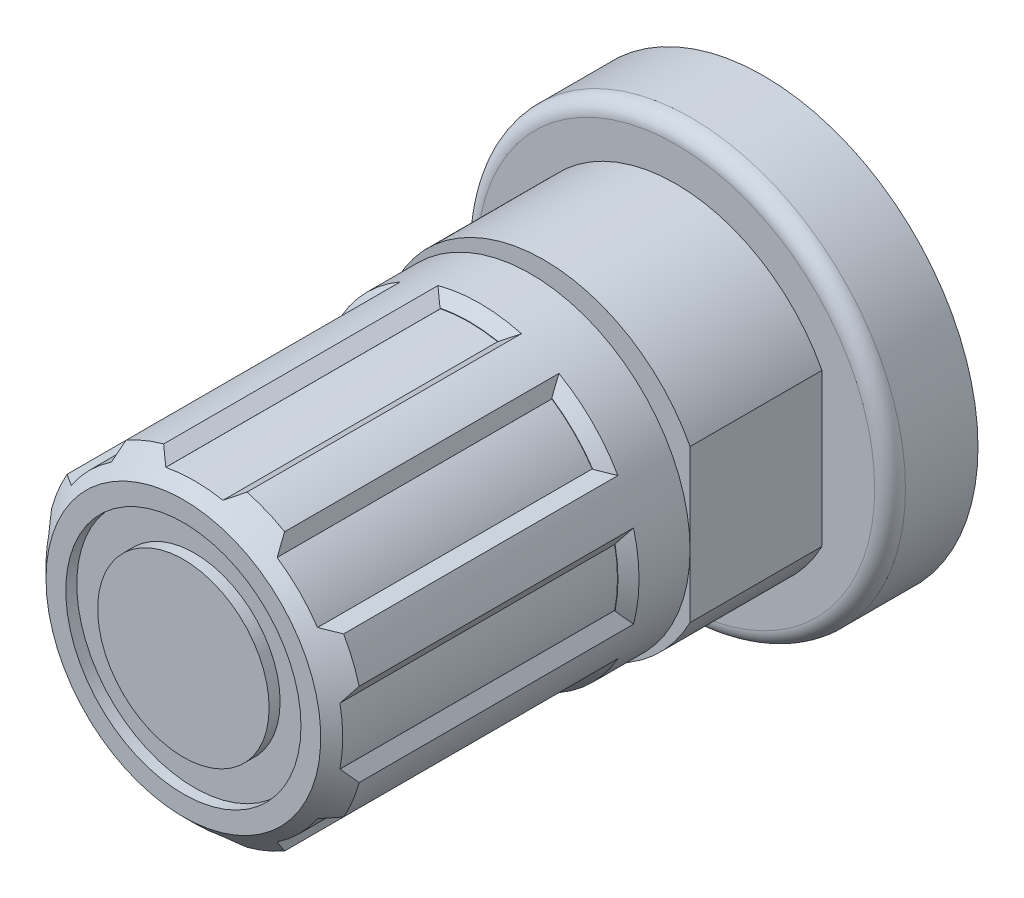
SolidWorks part; units mm, degrees
ref_plane "Front" through (0, 0, 0) normal (0, 0, 1) x (1, 0, 0)
ref_plane "Top" through (0, 0, 0) normal (0, 1, 0) x (1, 0, 0)
ref_plane "Right" through (0, 0, 0) normal (1, 0, 0) x (0, 0, -1)
sketch "Sketch1" plane through (0, 0, 0) normal (0, 0, 1) x (1, 0, 0)
  circle A0 centre (0, 0) radius 12.3825
  dimension "D1" = 24.765
extrude "Extrude1" add sketch "Sketch1" along normal blind 5.08
sketch "Sketch2" plane through (0, 0, 0) normal (0, 0, -1) x (-1, 0, 0)
  circle A0 centre (0, 0) radius 1.905
  dimension "D1" = 3.81
extrude "Extrude2" add sketch "Sketch2" along normal blind 3.81
sketch "Sketch3" plane through (0, 0, 5.08) normal (0, 0, 1) x (1, 0, 0)
  circle A0 centre (0, 0) radius 9.525
  dimension "D1" = 19.05
extrude "Extrude3" add sketch "Sketch3" along normal blind 7.62
sketch "Sketch4" plane through (0, 0, 12.7) normal (0, 0, 1) x (1, 0, 0)
  line L1 (-8.4455, 21.7051) -> (8.4455, 21.7051)
  line L2 (-8.4455, 21.7051) -> (-8.4455, -15.0168)
  line L3 (-8.4455, -15.0168) -> (8.4455, -15.0168)
  line L4 (8.4455, 21.7051) -> (8.4455, -15.0168)
  dimension "D1" = 16.891
  dimension "D2" = 8.4455
extrude "Cut-Extrude1" cut sketch "Sketch4" against normal blind 7.62 flip side to cut
sketch "Sketch5" plane through (0, 0, 12.7) normal (0, 0, 1) x (1, 0, 0)
  circle A0 centre (0, 0) radius 7.1755
  dimension "D1" = 14.351
extrude "Extrude4" add sketch "Sketch5" along normal blind 0.762
sketch "Sketch6" plane through (0, 0, 13.462) normal (0, 0, 1) x (1, 0, 0)
  circle A0 centre (0, 0) radius 9.2075
  dimension "D1" = 18.415
extrude "Extrude5" add sketch "Sketch6" along normal blind 20.066
fillet "Fillet1" radius 0.889 1 edges at (12.3825, 0, 5.08)
sketch "Sketch7" plane through (0, 0, 33.528) normal (0, 0, 1) x (1, 0, 0)
  line L1 (-1.7733, 9.0351) -> (-1.651, 8.412)
  line L2 (1.651, 8.412) -> (1.7733, 9.0351)
  arc A0 (1.7733, 9.0351) -> (-1.7733, 9.0351) centre (0, 0) ccw
  arc A1 (1.651, 8.412) -> (-1.651, 8.412) centre (0, 0) ccw
  circle A2 centre (0, 0) radius 9.2075 construction
  dimension "D1" = 17.145
  dimension "D2" = 3.302
extrude "Cut-Extrude2" cut sketch "Sketch7" against normal blind 16.51
chamfer "Chamfer1" distance 0.6096 angle 45 3 edges at (0, 9.2075, 17.018) (-1.7733, 9.0351, 25.273) (1.7733, 9.0351, 25.273)
pattern_circular "CirPattern1" count 8 over 360 about axis through (0, 0, 0) along (0, 0, 1) of "Chamfer1", "Cut-Extrude2"
sketch "Sketch8" plane through (0, 0, 0) normal (1, 0, 0) x (0, 0, -1)
  line L0 (-33.528, 9.2075) -> (-33.528, 7.9375)
  line L2 (-33.528, 7.9375) -> (-32.258, 9.2075)
  line L4 (-32.258, 9.2075) -> (-33.528, 9.2075)
  line L7 (-33.528, 7.1156) -> (-33.528, 4.7808) construction
  line L8 (-17.018, 0) -> (-33.528, 0) construction
  dimension "D1" = 1.27
  dimension "D2" = 9.2075
revolve "Cut-Revolve1" cut sketch "Sketch8" angle 360 about axis through (0, 0, 17.018) along (0, 0, 1)
sketch "Sketch9" plane through (0, 0, 33.528) normal (0, 0, 1) x (1, 0, 0)
  circle A0 centre (0, 0) radius 6.7945
  circle A1 centre (0, 0) radius 4.953
  dimension "D1" = 13.589
  dimension "D2" = 9.906
extrude "Cut-Extrude3" cut sketch "Sketch9" against normal blind 0.635
